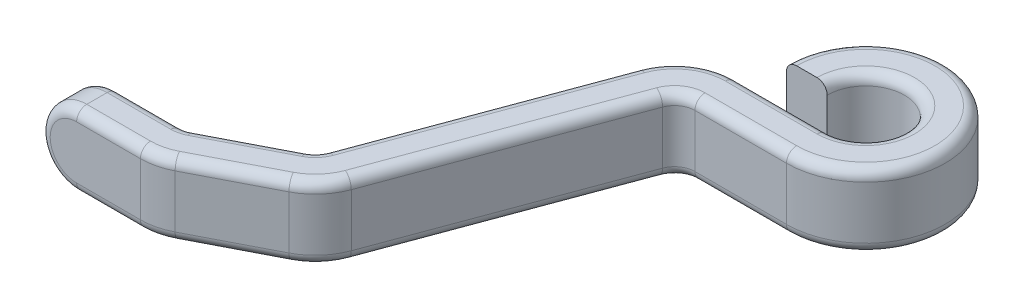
SolidWorks part; units mm, degrees
ref_plane "Front" through (0, 0, 0) normal (0, 0, 1) x (1, 0, 0)
ref_plane "Top" through (0, 0, 0) normal (0, 1, 0) x (1, 0, 0)
ref_plane "Right" through (0, 0, 0) normal (1, 0, 0) x (0, 0, -1)
sketch "Sketch1" plane through (0, 0, 0) normal (0, 0, 1) x (1, 0, 0)
  line L0 (5.3053, 0.9) -> (3.996, 0.9)
  line L1 (5.3053, -0.9) -> (5.3053, 0.9)
  line L2 (3.996, -0.9) -> (5.3053, -0.9)
  line L3 (5.4053, -1.0222) -> (5.4053, 1.0222)
  line L4 (5.3093, 0.95) -> (3.996, 0.95)
  line L5 (5.3093, 0.95) -> (3.996, 0.95) construction
  line L6 (5.4053, -1.0222) -> (5.4053, 1.0222) construction
  line L7 (3.996, -0.95) -> (5.3093, -0.95)
  line L8 (3.996, -0.95) -> (5.3093, -0.95) construction
  arc A0 (3.996, 0.9) -> (3.996, -0.9) centre (3.996, 0) ccw
  arc A1 (3.996, 0.95) -> (3.996, -0.95) centre (3.996, 0) ccw
  arc A2 (3.996, 0.95) -> (3.996, -0.95) centre (3.996, 0) ccw construction
  arc A21 (5.3093, 0.95) -> (5.4053, 1.0222) centre (5.3093, 1.05) ccw
  arc A22 (5.3093, 0.95) -> (5.4053, 1.0222) centre (5.3093, 1.05) ccw construction
  arc A23 (5.4053, -1.0222) -> (5.3093, -0.95) centre (5.3093, -1.05) ccw
  arc A24 (5.4053, -1.0222) -> (5.3093, -0.95) centre (5.3093, -1.05) ccw construction
  dimension "D1" = 0
  dimension "D2" = 0.1
extrude "Base-Extrude" add sketch "Sketch1" along normal blind 1
sketch "Sketch2" plane through (0, 0, 0) normal (0, 1, 0) x (1, 0, 0)
  line L0 (5.3053, -1) -> (5.3053, 0) construction
  line L1 (5.3053, -1) -> (5.3053, 0) construction
  line L2 (13.6003, 8.7927) -> (7.5184, 8.7927) construction
  line L3 (13.6003, 8.7927) -> (13.6003, 3.4625) construction
  line L4 (13.6003, 7.3427) -> (11.3503, 7.3427)
  line L5 (5.3053, -0.5) -> (5.5625, -0.5)
  line L6 (10.4125, 6.6898) -> (8.3456, 1.1052)
  line L7 (6.0211, -0.3886) -> (7.8664, 0.5637)
  arc A0 (7.8664, 0.5637) -> (8.3456, 1.1052) centre (7.4078, 1.4523) ccw
  circle A1 centre (13.6003, 8.7927) radius 0.95 construction
  circle A2 centre (13.6003, 8.7927) radius 0.95 construction
  arc A3 (13.6003, 7.3427) -> (12.1503, 8.7927) centre (13.6003, 8.7927) ccw
  arc A4 (6.0211, -0.3886) -> (5.5625, -0.5) centre (5.5625, 0.5) cw
  arc A5 (10.4125, 6.6898) -> (11.3503, 7.3427) centre (11.3503, 6.3427) cw
sketch "Sketch3" plane through (5.3053, 0, 0) normal (1, 0, 0) x (0, 0, -1)
  line L4 (0, -0.9) -> (0, 0.9)
  line L5 (0, 0.9) -> (-1, 0.9)
  line L6 (-1, 0.9) -> (-1, -0.9)
  line L7 (-1, -0.9) -> (0, -0.9)
  line L8 (0, -0.9) -> (0, 0.9)
  line L9 (0, 0.9) -> (-1, 0.9)
  line L10 (-1, 0.9) -> (-1, -0.9)
  line L11 (-1, -0.9) -> (0, -0.9)
  dimension "D1" = 0
sweep "Boss-Sweep1" add profiles "Sketch3" path "Sketch2"
fillet "Fillet2" radius 0.25 17 edges at (4.7793, 0.9, 1) (14.9792, -0.9, -10.1715) (12.4753, -0.9, -6.8427) (11.0646, -0.9, -6.753) (9.848, -0.9, -3.7239) (8.5311, -0.9, -0.4582) (7.173, -0.9, 0.3568) (5.9164, -0.9, 0.9576) (5.9164, 0.9, 0.9576) (7.173, 0.9, 0.3568) (8.5311, 0.9, -0.4582) (9.848, 0.9, -3.7239) (11.0646, 0.9, -6.753) (12.4753, 0.9, -6.8427) (14.9792, 0.9, -10.1715) (3.096, 0, 1) (4.7793, -0.9, 1)
fillet "Fillet3" radius 0.25 17 edges at (14.2721, 0.9, -9.4644) (12.4753, 0.9, -7.8427) (10.4933, 0.9, -7.5737) (8.9101, 0.9, -4.071) (7.7822, 0.9, -1.121) (6.7144, 0.9, -0.5318) (5.6805, 0.9, -0.0141) (5.6805, -0.9, -0.0141) (6.7144, -0.9, -0.5318) (7.7822, -0.9, -1.121) (8.9101, -0.9, -4.071) (10.4933, -0.9, -7.5737) (12.4753, -0.9, -7.8427) (14.2721, -0.9, -9.4644) (4.7793, 0.9, 0) (4.7793, -0.9, 0) (3.096, 0, 0)
